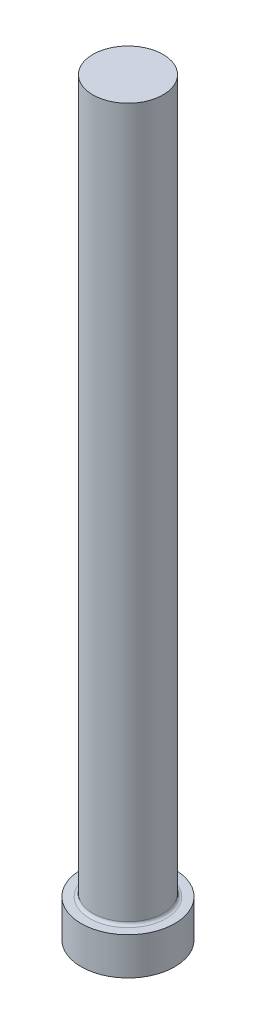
SolidWorks part; units mm, degrees
ref_plane "Front Plane" through (0, 0, 0) normal (0, 0, 1) x (1, 0, 0)
ref_plane "Top Plane" through (0, 0, 0) normal (0, 1, 0) x (1, 0, 0)
ref_plane "Right Plane" through (0, 0, 0) normal (1, 0, 0) x (0, 0, -1)
sketch "Sketch1" plane through (0, 0, 0) normal (0, 0, 1) x (1, 0, 0)
  line L0 (0, 0) -> (0, -1.906) construction
  line L1 (0, 0) -> (3.9624, 0)
  line L2 (3.9624, 0) -> (3.9624, 3.175)
  line L3 (3.9624, 3.175) -> (3.2258, 3.175)
  line L4 (2.9718, 3.429) -> (2.9718, 63.5)
  line L6 (0, 63.5) -> (2.9718, 63.5)
  line L7 (0, 63.5) -> (0, 0)
  arc A0 (3.2258, 3.175) -> (2.9718, 3.429) centre (3.2258, 3.429) cw
  dimension "D5" = 0.254
  dimension "D" = 5.9436
  dimension "H" = 7.9248
  dimension "D4" = 63.5
  dimension "T" = 3.175
revolve "Revolve3" add sketch "Sketch1" angle 360 about L0
